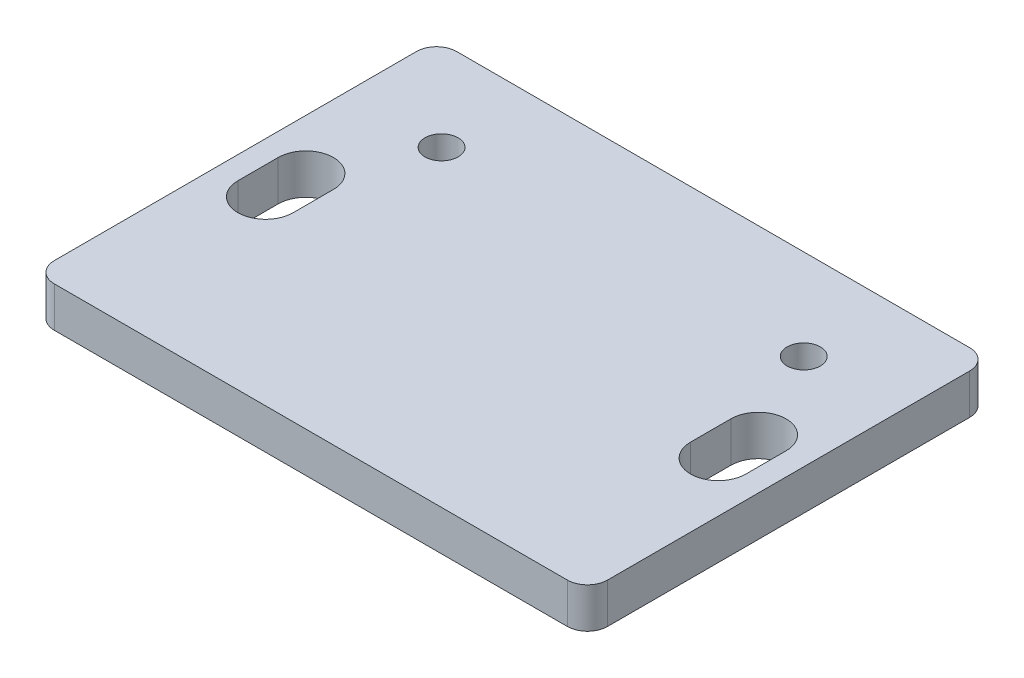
SolidWorks part; units mm, degrees
ref_plane "Ebene vorne" through (0, 0, 0) normal (0, 0, 1) x (1, 0, 0)
ref_plane "Ebene oben" through (0, 0, 0) normal (0, 1, 0) x (1, 0, 0)
ref_plane "Ebene rechts" through (0, 0, 0) normal (1, 0, 0) x (0, 0, -1)
sketch "Skizze1" plane through (0, 0, 0) normal (0, 1, 0) x (1, 0, 0)
  line L1 (-27.5, -20) -> (27.5, -20)
  line L2 (-27.5, -20) -> (-27.5, 20)
  line L3 (-27.5, 20) -> (27.5, 20)
  line L4 (27.5, -20) -> (27.5, 20)
  line L5 (-27.5, -20) -> (27.5, 20) construction
  line L6 (-27.5, 20) -> (27.5, -20) construction
  point P0 (0, 0)
  dimension "D1" = 55
  dimension "D2" = 40
extrude "Aufsatz-Linear austragen1" add sketch "Skizze1" along normal blind 4
hole_wizard "M4 Gewindebohrung1" positions "Skizze2" profile "Skizze3" tap size "M4" standard "DIN"
sketch "Skizze2" plane through (0, 4, 0) normal (0, 1, 0) x (1, 0, 0)
  line L0 (0, 0) -> (0, 21.2242) construction
  line L2 (27.5, 20) -> (-27.5, 20) construction
  point P0 (-18, 11)
  point P2 (18, 11)
  dimension "D1" = 9
  dimension "D2" = 36
sketch "Skizze3" plane through (-18, 4, -11) normal (1, 0, 0) x (0, 0, 1)
  line L0 (0, 0) -> (0, 4)
  line L1 (0, 4) -> (1.65, 4)
  line L2 (1.65, 4) -> (1.65, 0)
  line L5 (1.65, 0) -> (0, 0)
  line L11 (0, -6.35) -> (0, 107.95) construction
  dimension "Bohrerdurchmesser" = 3.3
  dimension "Bohrungstiefe" = 4
sketch "Skizze4" plane through (0, 4, 0) normal (0, 1, 0) x (1, 0, 0)
  line L0 (-22.5, -2) -> (-22.5, 2) construction
  line L1 (-25.25, -2) -> (-25.25, 2)
  line L2 (-19.75, -2) -> (-19.75, 2)
  line L3 (22.5, -2) -> (22.5, 2) construction
  line L4 (19.75, -2) -> (19.75, 2)
  line L5 (25.25, -2) -> (25.25, 2)
  line L6 (0, 0) -> (0, -23.6481) construction
  line L7 (27.5, 20) -> (-27.5, 20) construction
  arc A0 (-25.25, -2) -> (-19.75, -2) centre (-22.5, -2) ccw
  arc A1 (-19.75, 2) -> (-25.25, 2) centre (-22.5, 2) ccw
  arc A2 (19.75, -2) -> (25.25, -2) centre (22.5, -2) ccw
  arc A3 (25.25, 2) -> (19.75, 2) centre (22.5, 2) ccw
  point P2 (-22.5, 0)
  point P8 (22.5, 0)
  dimension "D1" = 5.5
  dimension "D2" = 4
  dimension "D3" = 20
  dimension "D4" = 45
extrude "Schnitt-Linear austragen1" cut sketch "Skizze4" against normal through all
fillet "Verrundung1" radius 2 4 edges at (-27.5, 2, 20) (-27.5, 2, -20) (27.5, 2, -20) (27.5, 2, 20)
